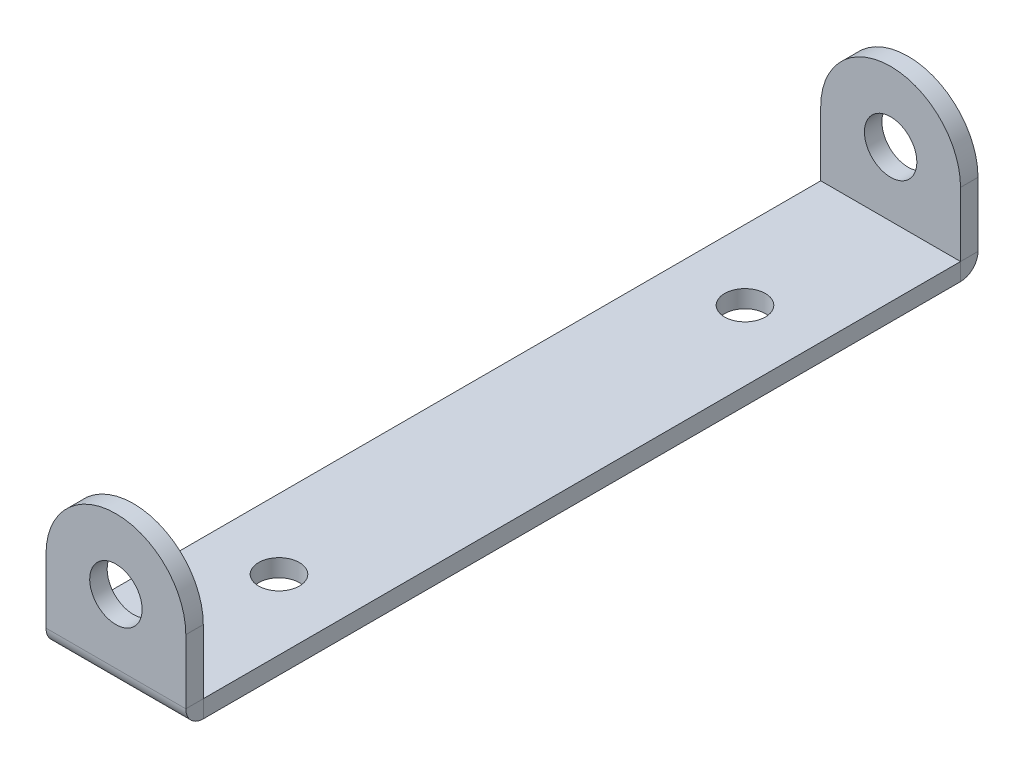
SolidWorks part; units mm, degrees
ref_plane "Front" through (0, 0, 0) normal (0, 0, 1) x (1, 0, 0)
ref_plane "Top" through (0, 0, 0) normal (0, 1, 0) x (1, 0, 0)
ref_plane "Right" through (0, 0, 0) normal (1, 0, 0) x (0, 0, -1)
sketch "Sketch1" plane through (0, 0, 0) normal (0, 1, 0) x (1, 0, 0)
  line L1 (6, 0) -> (6, 82)
  line L2 (-6, 0) -> (-6, 82)
  circle A0 centre (0, 82) radius 2.25
  circle A1 centre (0, 0) radius 2.25
  arc A2 (6, 82) -> (-6, 82) centre (0, 82) ccw
  arc A3 (-6, 0) -> (6, 0) centre (0, 0) ccw
  circle A4 centre (0, 61) radius 1.75
  circle A5 centre (0, 21) radius 1.75
sheet metal parameters "Sheet-Metal1" thickness 1.5 parameters "D1"=0
base flange "Base-Flange1" sketch "Sketch1" thickness 1.5 reverse thickness direction yes parameters "D1"=0
sketch "Sketch3" plane through (0, 1.5, 0) normal (0, 1, 0) x (-1, 0, 0)
  line L3 (6, -7) -> (-6, -7)
  line L4 (6, -75) -> (-6, -75)
sketched bend "Sketched Bend1" parameters "D1"=0
bend "SketchBend1" bend radius 0 bend angle 90 parameters "D5"=1
bend "SketchBend2" bend radius 0 bend angle 90 parameters "D5"=2
flat pattern "Flat-Pattern1"
sketch "Bend-Lines1" plane through (0, 1.5, 0) normal (0, 1, 0) x (-1, 0, 0)
  line L0 (6, -74.995) -> (-6, -74.995) construction
  line L1 (-6, -7.005) -> (6, -7.005) construction
bend of the flat pattern "Flatten-<SketchBend1>1"
bend of the flat pattern "Flatten-<SketchBend2>1"
